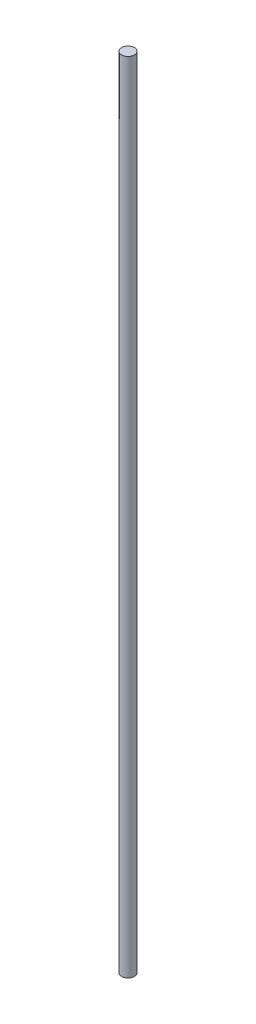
SolidWorks part; units mm, degrees
ref_plane "Front" through (0, 0, 0) normal (0, 0, 1) x (1, 0, 0)
ref_plane "Top" through (0, 0, 0) normal (0, 1, 0) x (1, 0, 0)
ref_plane "Right" through (0, 0, 0) normal (1, 0, 0) x (0, 0, -1)
sketch "草图1" plane through (0, 0, 0) normal (0, 1, 0) x (1, 0, 0)
  circle A0 centre (0, 0) radius 1.5
  dimension "D1" = 3
extrude "凸台-拉伸1" add sketch "草图1" along normal blind 187
